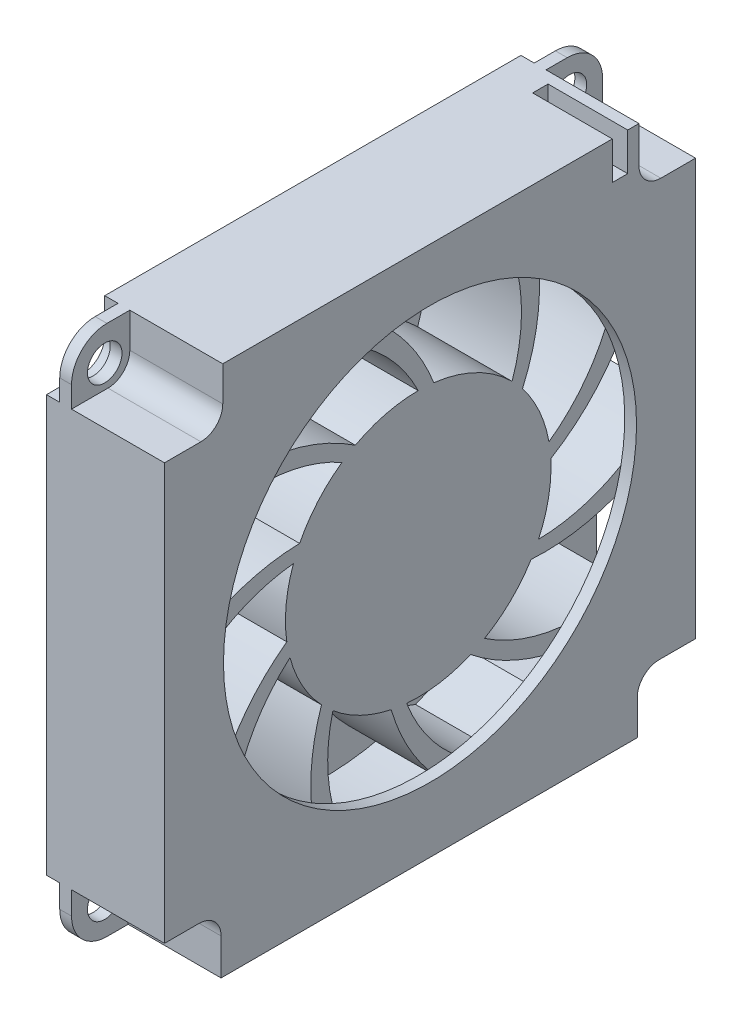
SolidWorks part; units mm, degrees
other "NONE"
ref_plane "Ebene vorne" through (0, 0, 0) normal (0, 0, 1) x (1, 0, 0)
ref_plane "Ebene oben" through (0, 0, 0) normal (0, 1, 0) x (1, 0, 0)
ref_plane "Ebene rechts" through (0, 0, 0) normal (1, 0, 0) x (0, 0, -1)
imported_body "Importiert1"
sketch "Skizze1" plane through (251.1111, 0, 0) normal (1, 0, 0) x (0, 0, -1)
  line L1 (37.4821, 220.3165) -> (88.956, 220.3165)
  line L2 (37.4821, 220.3165) -> (37.4821, 162.5497)
  line L3 (37.4821, 162.5497) -> (88.956, 162.5497)
  line L4 (88.956, 220.3165) -> (88.956, 162.5497)
extrude "Schnitt-Linear austragen1" cut sketch "Skizze1" along normal blind 90
sketch "Skizze2" plane through (250.2222, 0, 0) normal (1, 0, 0) x (0, 0, -1)
  circle A0 centre (64, 190.2222) radius 15.5556
  arc A1 (52.4386, 200.6294) -> (75.5614, 200.6294) centre (64, 190.2222) ccw construction
extrude "Schnitt-Linear austragen2" cut sketch "Skizze2" along normal blind 21
